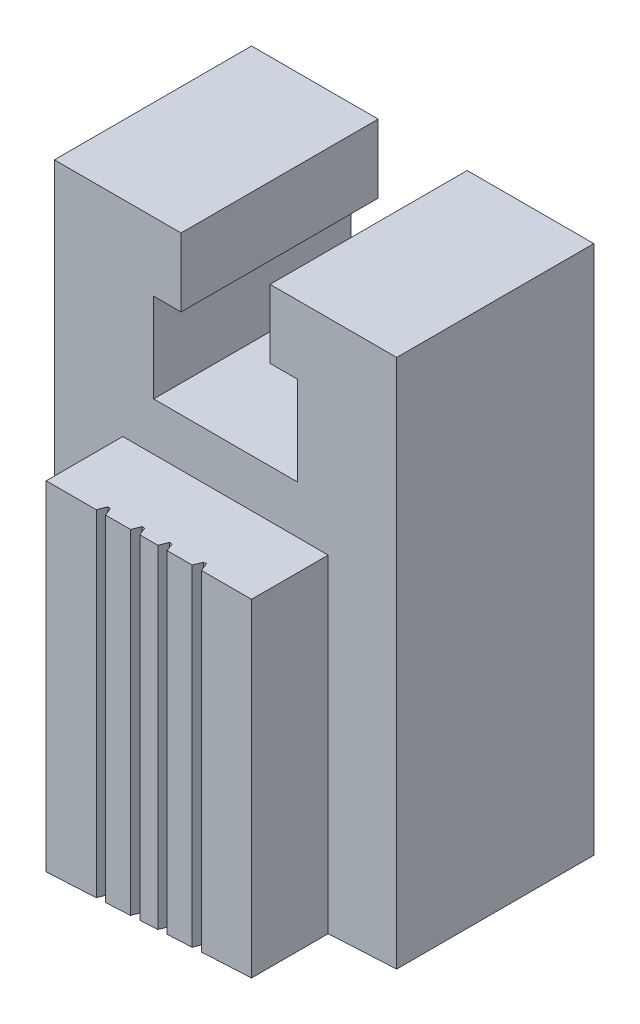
SolidWorks part; units mm, degrees
ref_plane "前视基准面" through (0, 0, 0) normal (0, 0, 1) x (1, 0, 0)
ref_plane "上视基准面" through (0, 0, 0) normal (0, 1, 0) x (1, 0, 0)
ref_plane "右视基准面" through (0, 0, 0) normal (1, 0, 0) x (0, 0, -1)
sketch "草图1" plane through (0, 0, 0) normal (0, 0, 1) x (1, 0, 0)
  line L0 (0, 0) -> (25, 1.3102)
  line L1 (0, 40) -> (9.25, 40)
  line L2 (0, 0) -> (0, 40)
  line L3 (25, 1.3102) -> (25, 40)
  line L4 (7.25, 35) -> (9.25, 35)
  line L5 (7.25, 28.5) -> (17.75, 28.5)
  line L6 (7.25, 35) -> (7.25, 28.5)
  line L7 (17.75, 35) -> (17.75, 28.5)
  line L8 (9.25, 40) -> (9.25, 35)
  line L9 (15.75, 40) -> (15.75, 35)
  line L10 (15.75, 35) -> (17.75, 35)
  line L11 (15.75, 40) -> (25, 40)
extrude "凸台-拉伸1" add sketch "草图1" along normal blind 20
sketch "草图2" plane through (25, 0, 0) normal (1, 0, 0) x (0, 0, -1)
  line L0 (-20, 0) -> (0, 0)
  line L1 (-20, 0) -> (-20, 25)
  line L2 (-14.4, 25) -> (-14.4, 40)
  line L3 (0, 0) -> (0, 40)
  line L4 (-20, 25) -> (-14.4, 25)
  line L5 (-14.4, 40) -> (0, 40)
extrude "切除-拉伸1" cut sketch "草图2" against normal through all flip side to cut
sketch "草图3" plane through (0, 40, 0) normal (0, 1, 0) x (1, 0, 0)
  line L0 (0, -14.4) -> (0, 0)
  line L1 (25, -14.4) -> (25, 0)
  line L2 (5, -20) -> (8.66, -20)
  line L3 (0, 0) -> (25, 0)
  line L4 (0, -14.4) -> (5, -14.4)
  line L5 (5, -20) -> (5, -14.4)
  line L6 (20, -20) -> (20, -14.4)
  line L7 (8.9, -19.4) -> (8.66, -20)
  line L8 (9.1, -19.4) -> (9.34, -20)
  line L9 (9.1, -19.4) -> (8.9, -19.4)
  line L10 (11.6, -19.4) -> (11.4, -19.4)
  line L11 (11.6, -19.4) -> (11.84, -20)
  line L12 (11.4, -19.4) -> (11.16, -20)
  line L13 (13.4, -19.4) -> (13.16, -20)
  line L14 (13.6, -19.4) -> (13.84, -20)
  line L15 (13.6, -19.4) -> (13.4, -19.4)
  line L16 (16.1, -19.4) -> (15.9, -19.4)
  line L17 (16.1, -19.4) -> (16.34, -20)
  line L18 (15.9, -19.4) -> (15.66, -20)
  line L19 (16.34, -20) -> (20, -20)
  line L20 (13.84, -20) -> (15.66, -20)
  line L21 (11.84, -20) -> (13.16, -20)
  line L22 (9.34, -20) -> (11.16, -20)
  line L23 (20, -14.4) -> (25, -14.4)
extrude "切除-拉伸2" cut sketch "草图3" against normal through all flip side to cut
